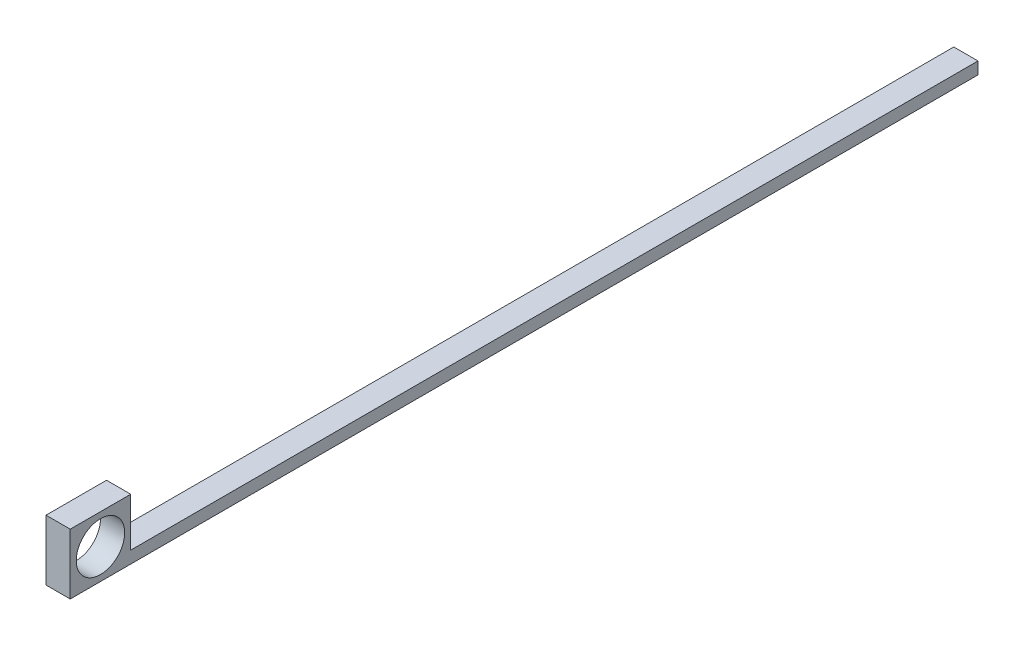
SolidWorks part; units mm, degrees
ref_plane "Front Plane" through (0, 0, 0) normal (0, 0, 1) x (1, 0, 0)
ref_plane "Top Plane" through (0, 0, 0) normal (0, 1, 0) x (1, 0, 0)
ref_plane "Right Plane" through (0, 0, 0) normal (1, 0, 0) x (0, 0, -1)
sketch "Sketch1" plane through (0, 0, 0) normal (1, 0, 0) x (0, 0, -1)
  line L1 (0, 0) -> (50, 0)
  line L2 (0, 0) -> (0, 50)
  line L3 (0, 50) -> (50, 50)
  line L4 (50, 0) -> (50, 50)
  circle A0 centre (25, 25) radius 20
extrude "Boss-Extrude1" add sketch "Sketch1" along normal blind 20
sketch "Sketch4" plane through (0, 0, -50) normal (0, 0, -1) x (-1, 0, 0)
  line L0 (-20, 0) -> (-20, 50) construction
  line L1 (0, 0) -> (-20, 0)
  line L2 (0, 0) -> (0, 10)
  line L3 (0, 10) -> (-20, 10)
  line L4 (-20, 0) -> (-20, 10)
extrude "Boss-Extrude2" add sketch "Sketch4" along normal blind 700
